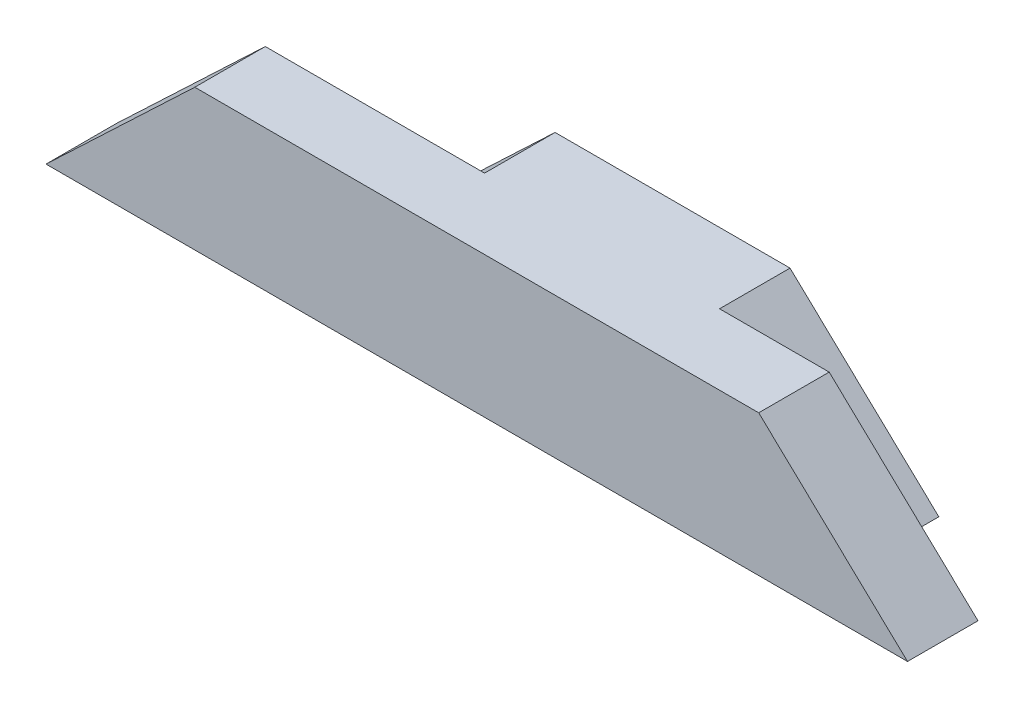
SolidWorks part; units mm, degrees
ref_plane "Plan de face" through (0, 0, 0) normal (0, 0, 1) x (1, 0, 0)
ref_plane "Plan de dessus" through (0, 0, 0) normal (0, 1, 0) x (1, 0, 0)
ref_plane "Plan de droite" through (0, 0, 0) normal (1, 0, 0) x (0, 0, -1)
sketch "Esquisse1" plane through (0, 0, 0) normal (0, 0, 1) x (1, 0, 0)
  line L1 (0, 0) -> (62, 0)
  line L2 (0, 0) -> (0, 9)
  line L3 (0, 9) -> (62, 9)
  line L4 (62, 0) -> (62, 9)
  dimension "D1" = 62
  dimension "D2" = 9
extrude "Extrusion1" add sketch "Esquisse1" along normal blind 9
sketch "Esquisse2" plane through (0, 0, 9) normal (0, 0, 1) x (1, 0, 0)
  line L0 (62, 9) -> (52.5, 9)
  line L1 (62, 9) -> (0, 9) construction
  line L2 (52.5, 9) -> (62, 0)
  line L3 (62, 0) -> (62, 9)
  line L4 (0, 9) -> (9.5, 9)
  line L5 (9.5, 9) -> (0, 0)
  line L6 (0, 0) -> (0, 9)
  dimension "D1" = 43
  dimension "D2" = 9.5
extrude "Enlèv. mat.-Extru.2" cut sketch "Esquisse2" against normal blind 9
sketch "Esquisse3" plane through (0, 0, 0) normal (0, 0, -1) x (-1, 0, 0)
  line L0 (-9.5, 9) -> (-23.5, 9)
  line L1 (-52.5, 9) -> (-9.5, 9) construction
  line L2 (-23.5, 9) -> (-14, 0)
  line L3 (0, 0) -> (-62, 0) construction
  line L4 (-14, 0) -> (0, 0)
  line L5 (0, 0) -> (-9.5, 9)
  line L6 (-52.5, 9) -> (-38.5, 9)
  line L7 (-38.5, 9) -> (-48, 0)
  line L8 (-48, 0) -> (-62, 0)
  line L9 (-62, 0) -> (-52.5, 9)
  dimension "D1" = 14
  dimension "D2" = 14
  dimension "D3" = 14
  dimension "D4" = 14
extrude "Enlèv. mat.-Extru.3" cut sketch "Esquisse3" against normal blind 4.5
sketch "Esquisse4" plane through (0, 0, 4.5) normal (0, 0, -1) x (-1, 0, 0)
  line L0 (-62, 0) -> (-55, 0)
  line L1 (-62, 0) -> (-48, 0) construction
  line L2 (-55, 0) -> (-45.5, 9)
  line L3 (-38.5, 9) -> (-52.5, 9) construction
  line L4 (-45.5, 9) -> (-52.5, 9)
  line L5 (-52.5, 9) -> (-62, 0)
  dimension "D1" = 7
extrude "Enlèv. mat.-Extru.4" cut sketch "Esquisse4" against normal blind 10
